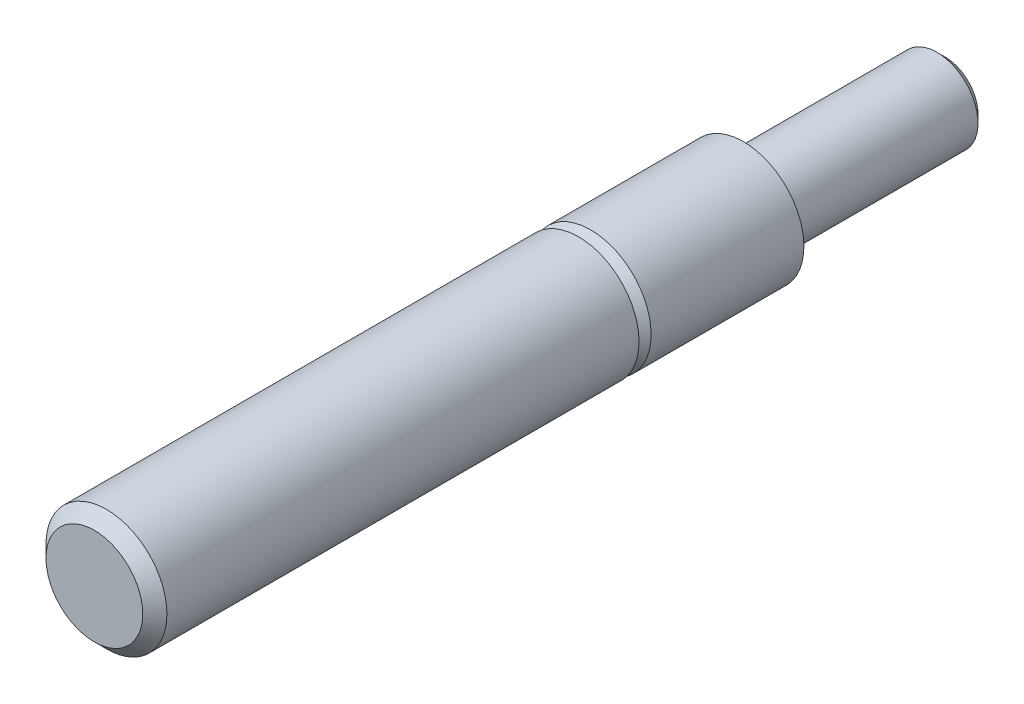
SolidWorks part; units mm, degrees
ref_plane "Front" through (0, 0, 0) normal (0, 0, 1) x (1, 0, 0)
ref_plane "Top" through (0, 0, 0) normal (0, 1, 0) x (1, 0, 0)
ref_plane "Right" through (0, 0, 0) normal (1, 0, 0) x (0, 0, -1)
sketch "Sketch1" plane through (0, 0, 0) normal (1, 0, 0) x (0, 0, -1)
  line L0 (0, 0) -> (65.3053, 0) construction
  line L1 (0, 0) -> (0, 2.8011)
  line L2 (0, 2.8011) -> (0.7003, 3.5014)
  line L3 (0.7003, 3.5014) -> (28.0416, 3.5014)
  line L4 (28.0416, 3.5014) -> (28.0416, 2.8011)
  line L5 (28.0416, 2.8011) -> (28.7419, 3.5014)
  line L6 (28.7419, 3.5014) -> (37.592, 3.5014)
  line L7 (37.592, 3.5014) -> (37.592, 2.1374)
  line L8 (37.592, 2.1374) -> (38.067, 2.3749)
  line L9 (38.067, 2.3749) -> (48.801, 2.3749)
  line L10 (48.801, 2.3749) -> (49.276, 1.8999)
  line L11 (49.276, 1.8999) -> (49.276, 0)
  line L12 (0, 0) -> (49.276, 0)
revolve "Revolve1" add sketch "Sketch1" angle 360 about L0
sketch "Sketch2" plane through (0, 0, -37.592) normal (0, 0, -1) x (-1, 0, 0)
  circle A0 centre (0, 0) radius 53.975
  dimension "D1" = 107.95
extrude "Type123-N" [suppressed] cut sketch "Sketch2" along normal through all
sketch "123KeyDepth" [suppressed] plane through (0, 0, -28.448) normal (0, 0, -1) x (-1, 0, 0)
  line L0 (0, 0) -> (0, 1.5748) construction
  line L1 (-0.5766, 1.5748) -> (0.5714, 1.5748) construction
ref_plane "123Plane" [suppressed] through (0, 1.5748, 0) normal (0, -1, 0) x (1, 0, 0)
sketch "Sketch4" [suppressed] plane through (0, 1.5748, 0) normal (0, -1, 0) x (1, 0, 0)
  line L0 (0.0026, -28.448) -> (0.0026, -38.0533) construction
  line L1 (0.5766, -28.448) -> (-0.5714, -28.448) construction
  line L2 (0.8027, -28.448) -> (0.8027, -19.812)
  line L3 (-0.7975, -19.812) -> (-0.7975, -28.448)
  line L5 (-3.9689, -19.812) -> (2.9563, -19.812) construction
  line L6 (-1.8999, -28.448) -> (1.8999, -28.448) construction
  line L7 (-0.7975, -28.448) -> (0.8027, -28.448)
  arc A0 (0.8027, -19.812) -> (-0.7975, -19.812) centre (0.0026, -19.812) ccw
extrude "123Key" [suppressed] cut sketch "Sketch4" against normal through all
sketch "Sketch5" plane through (0, 0, -28.0416) normal (0, 0, -1) x (-1, 0, 0)
  circle A0 centre (0, 0) radius 63.5
  dimension "D1" = 127
extrude "Type4" [suppressed] cut sketch "Sketch5" along normal through all
chamfer "Type4-Chamfer" [suppressed] distance 2.54 angle 45
sketch "4KeyDepth" [suppressed] plane through (0, 0, -72.136) normal (0, 0, -1) x (-1, 0, 0)
  line L0 (0, 0) -> (0, 9.525) construction
  line L1 (-17.7759, 9.525) -> (18.3619, 9.525) construction
ref_plane "4Plane" [suppressed] through (0, 9.525, 0) normal (0, -1, 0) x (1, 0, 0)
sketch "Sketch7" [suppressed] plane through (0, 9.525, 0) normal (0, -1, 0) x (1, 0, 0)
  line L0 (-0.293, -72.136) -> (-0.293, -158.7004) construction
  line L1 (17.7759, -72.136) -> (-18.3619, -72.136) construction
  line L2 (2.882, -72.136) -> (2.882, -32.0291)
  line L3 (-3.468, -72.136) -> (-3.468, -32.0291)
  line L4 (-3.468, -72.136) -> (2.882, -72.136)
  line L5 (-10.16, -72.136) -> (10.16, -72.136) construction
  line L6 (-10.16, -72.136) -> (10.16, -72.136) construction
  arc A0 (2.882, -32.0291) -> (-3.468, -32.0291) centre (-0.293, -34.036) ccw
extrude "4Key" [suppressed] cut sketch "Sketch7" against normal through all
equation "\"DChamp3@Sketch1\"=.1*\"D@Sketch1\""
equation "\"DChamp1@Sketch1\"=.1*\"D@Sketch1\""
equation "\"DChamp2@Sketch1\"=.1*\"D@Sketch1\""
equation "\"DChamp4@Sketch1\"=.1*\"D@Sketch1\""
equation "\"CChamp1@Sketch1\"=.1*\"C@Sketch1\""
equation "\"CChamp5@Sketch1\"=.9*\"C@Sketch1\""
equation "\"CChamp3@Sketch1\"=.1*\"C@Sketch1\""
equation "\"CChamp4@Sketch1\"=.1*\"C@Sketch1\""
equation "\"D2@Sketch1\"=\"D@Sketch1\""
equation "\"KeyDepth@123KeyDepth\"=(\"C@Sketch1\"/2)-(\"F@Sketch4\"/2)"
equation "\"Type4KeyDepth@4KeyDepth\"=(\"D@Sketch1\"/2)-(\"4F@Sketch7\"/2)"
equation "\"4F2@Sketch7\"=\"4F@Sketch7\"/2"
